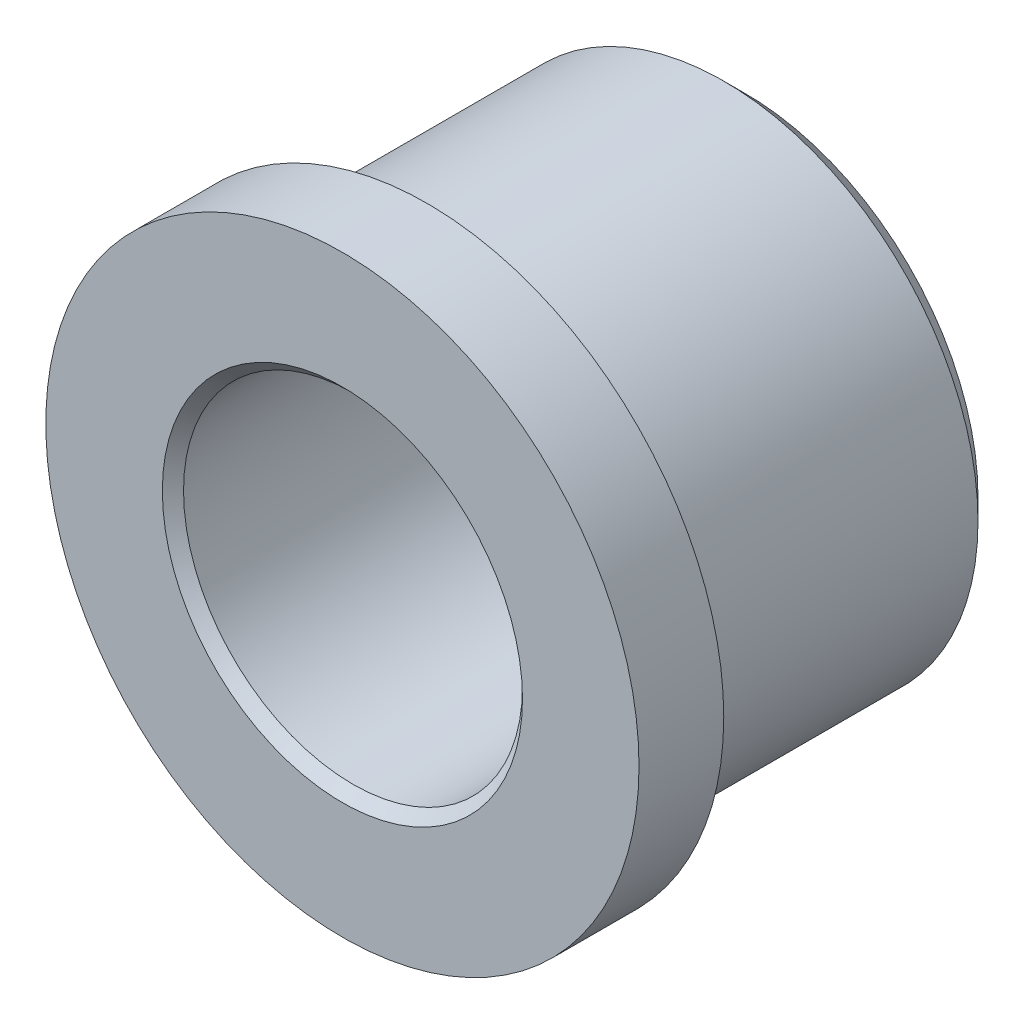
SolidWorks part; units mm, degrees
ref_plane "Plan1" through (0, 0, 0) normal (0, 0, 1) x (1, 0, 0)
ref_plane "Plan2" through (0, 0, 0) normal (0, 1, 0) x (1, 0, 0)
ref_plane "Plan3" through (0, 0, 0) normal (1, 0, 0) x (0, 0, -1)
sketch "Esquisse3" plane through (0, 0, 0) normal (0, 0, 1) x (1, 0, 0)
  circle A0 centre (0, 24.7771) radius 6 construction
  circle A1 centre (0, 24.7771) radius 6
  circle A2 centre (0, 24.7771) radius 7
  dimension "D1" = 1
extrude "Base-Extrusion" add sketch "Esquisse3" along normal blind 2
sketch "Esquisse4" plane through (0, 0, 2) normal (0, 0, 1) x (1, 0, 0)
  circle A0 centre (0, 24.7771) radius 6 construction
  circle A1 centre (0, 24.7771) radius 6
  circle A2 centre (0, 24.7771) radius 4
  dimension "D1" = 2
extrude "Boss.-Extru.1" add sketch "Esquisse4" against normal blind 9.5
chamfer "Chanfrein1" distance 0.25 angle 45
chamfer "Chanfrein2" distance 0.5 angle 45
